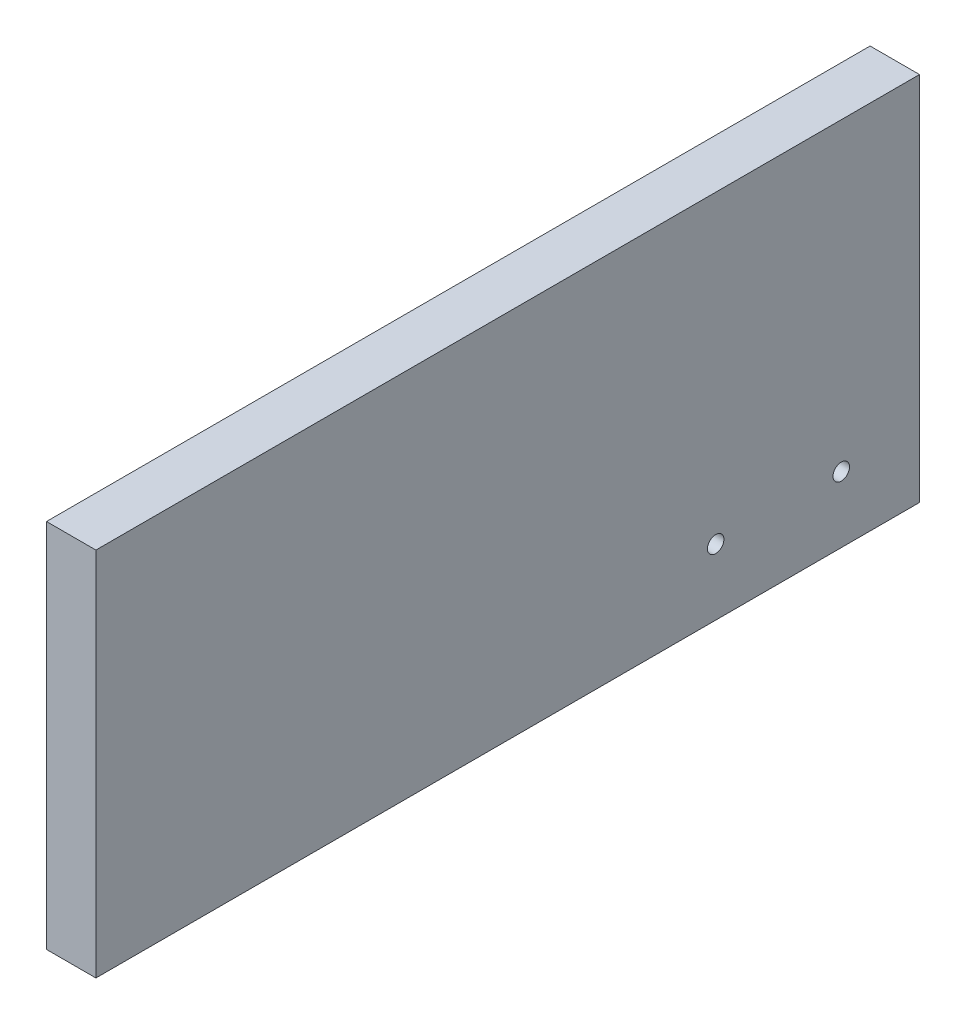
SolidWorks part; units mm, degrees
ref_plane "Front Plane" through (0, 0, 0) normal (0, 0, 1) x (1, 0, 0)
ref_plane "Top Plane" through (0, 0, 0) normal (0, 1, 0) x (1, 0, 0)
ref_plane "Right Plane" through (0, 0, 0) normal (1, 0, 0) x (0, 0, -1)
sketch "Sketch2" plane through (0, 0, 0) normal (0, 0, 1) x (1, 0, 0)
  line L1 (0, 0) -> (38.1, 0)
  line L2 (0, 0) -> (0, 285.75)
  line L3 (0, 285.75) -> (38.1, 285.75)
  line L4 (38.1, 0) -> (38.1, 285.75)
  line L5 (0, 0) -> (38.1, 285.75) construction
  line L6 (0, 285.75) -> (38.1, 0) construction
  point P4 (19.05, 142.875)
extrude "Boss-Extrude2" add sketch "Sketch2" along normal blind 635
sketch "Sketch3" plane through (38.1, 0, 0) normal (1, 0, 0) x (0, 0, -1)
  circle A0 centre (-157.1625, 50.8) radius 6.35 construction
  circle A1 centre (-157.1625, 50.8) radius 6.35
  circle A2 centre (-60.325, 50.8) radius 6.35 construction
  circle A3 centre (-60.325, 50.8) radius 6.35
extrude "Cut-Extrude1" cut sketch "Sketch3" against normal through all
equation "\"system_width\"= 7ft + 10 "
equation "\"system_length\"= 95.5"
equation "\"module_board_length\"= 11.25in"
equation "\"module_board_width\"= 1.5in"
equation "\"module_width\"= (\"system_width\" -  2* \"module_trim_thickness\") / 2"
equation "\"module_length\"= (\"system_top_length\" - \"module_trim_thickness\")/ 2"
equation "\"module_board_long_depth\"= \"module_length\" - \"module_lip_width\""
equation "\"module_board_short_depth\"= \"module_width\" - ( 2 * \"module_board_width\" ) - \"module_lip_width\""
equation "\"D1@Sketch2\"=\"module_board_length\""
equation "\"D2@Sketch2\"=\"module_board_width\""
equation "\"D1@Boss-Extrude2\"=\"module_board_long_depth\"-\"module_board_width\"*2"
equation "\"module_board_hole\"= 0.5in"
equation "\"module_board_hole_position\"= ( ( \"module_width\" - \"module_board_hole_seperation\" ) / 2 ) + \"module_board_width\"/2"
equation "\"module_board_hole_seperation\"= 20in"
equation "\"system_step_width\"= 3ft"
equation "\"system_top_length\"= \"system_length\" - \"system_step_length\""
equation "\"module_top_thickness\"= 0.75in"
equation "\"module_lip_width\"= 1.5in"
equation "\"module_trim_thickness\"= 1in"
equation "\"module_trim_height\"= 14in"
equation "\"module_top_length\"= \"module_length\" + \"module_lip_width\""
equation "\"module_top_width\"= \"module_width\" + \"module_lip_width\""
equation "\"step_board_length\"= 5.5in"
